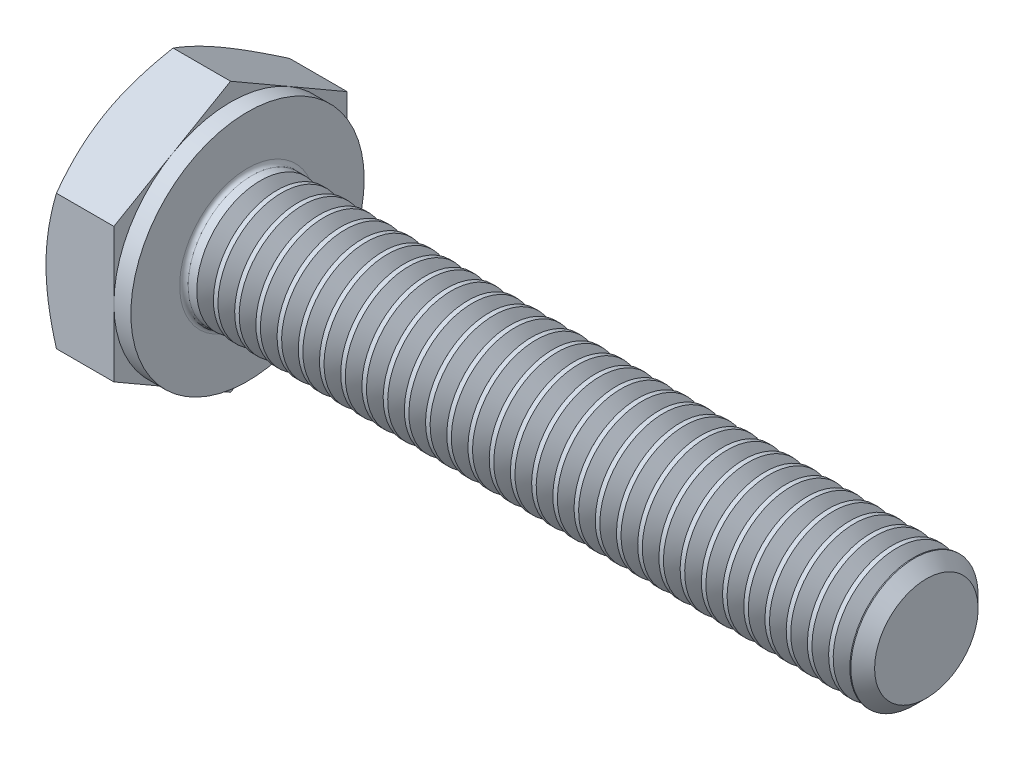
SolidWorks part; units mm, degrees
ref_plane "Plane1" through (0, 0, 0) normal (0, 0, 1) x (1, 0, 0)
ref_plane "Plane2" through (0, 0, 0) normal (0, 1, 0) x (1, 0, 0)
ref_plane "Plane3" through (0, 0, 0) normal (1, 0, 0) x (0, 0, -1)
sketch "Sketch1" plane through (0, 0, 0) normal (1, 0, 0) x (0, 0, -1)
  line L0 (2.75, 1.5877) -> (2.75, -1.5877)
  line L1 (-2.75, 1.5877) -> (-2.75, -1.5877)
  line L2 (2.75, -1.5877) -> (0, -3.1754)
  line L3 (0, -3.1754) -> (-2.75, -1.5877)
  line L4 (2.75, 1.5877) -> (0, 3.1754)
  line L5 (0, 3.1754) -> (-2.75, 1.5877)
  dimension "Width_flats" = 5.5
  dimension "D2" = 120
  dimension "D3" = 2.75
  dimension "D4" = 2.75
  dimension "D5" = 2.75
extrude "BaseHead" add sketch "Sketch1" along normal blind 2
sketch "BodySke" plane through (0, 0, 0) normal (0, 0, 1) x (1, 0, 0)
  line L0 (0, 1.5877) -> (0, -1.5877) construction
  line L1 (0, 0) -> (18, 0)
  line L2 (0, 0) -> (0, 1.5)
  line L3 (0, 1.5) -> (17.7195, 1.5)
  line L4 (18, 0) -> (18, 1.2195)
  line L5 (2, 3.1754) -> (2, 1.5877) construction
  line L6 (18, 1.2195) -> (17.7195, 1.5)
  line L7 (0, 0) -> (96.52, 0) construction
  line L8 (18, -1.2195) -> (17.7195, -1.5) construction
  line L9 (0, -1.5) -> (17.7195, -1.5) construction
  line L10 (2.5, 15.24) -> (2.5, -1.27) construction
  line L12 (2, 1.5877) -> (2, -1.5877) construction
  dimension "Length" = 16
  dimension "Body_ch_ang" = 45
  dimension "Diameter" = 3
  dimension "Minor_dia" = 2.439
  dimension "Advance" = 0.5
revolve "BaseBody" add sketch "BodySke"
fillet "HeadFillet" radius 0.1 1 edges at (2, 0, -1.5)
sketch "Sketch3" plane through (0, 0, 0) normal (0, 0, 1) x (1, 0, 0)
  line L0 (0, 2.75) -> (3.1324, 8.1754)
  line L1 (0, 3.1754) -> (0, 1.5877) construction
  line L2 (3.1324, 8.1754) -> (3.1324, 13.1754)
  line L3 (3.1324, 13.1754) -> (-10, 13.1754)
  line L4 (-10, 13.1754) -> (-10, 2.75)
  line L5 (-10, 2.75) -> (0, 2.75)
  line L6 (0, 0) -> (99.06, 0) construction
  line L7 (2, 3.1754) -> (0, 3.1754) construction
  dimension "D1" = 2.75
  dimension "D2" = 5
  dimension "D3" = 10
  dimension "D4" = 5
  dimension "Head_ch_ang" = 30
revolve "HeadChamfer" cut sketch "Sketch3" angle 360 about L6
sketch "Sketch4" plane through (0, 0, 0) normal (0, 0, 1) x (1, 0, 0)
  line L1 (2, 3.1754) -> (2, 1.5877) construction
  line L2 (2, 2.75) -> (1.6, 2.75)
  line L3 (2, 2.75) -> (2, 13.1754)
  line L4 (2, 13.1754) -> (1.6, 13.1754)
  line L5 (0, 0) -> (95.25, 0) construction
  line L6 (0, 0) -> (96.52, 0) construction
  line L7 (1.6, 2.75) -> (1.6, 13.1754)
  line L8 (2, 3.1754) -> (0.2456, 3.1754) construction
  dimension "D1" = 5.5
  dimension "D2" = 10
  dimension "Bearing_ht" = 0.4
revolve "BearingFace" cut sketch "Sketch4" angle 360 about L5
sketch "ThdSchSke" plane through (0, 0, 0) normal (0, 0, 1) x (1, 0, 0)
  line L0 (2.5, -1.2195) -> (2.3036, -1.5)
  line L1 (2.5, -1.2195) -> (2.6964, -1.5)
  line L2 (2.6964, -1.5) -> (2.6964, -1.875)
  line L3 (-3.175, 0) -> (5.1513, 0) construction
  line L5 (2.6964, -1.875) -> (2.3036, -1.875)
  line L6 (2.3036, -1.875) -> (2.3036, -1.5)
  dimension "Thread_minor" = 2.439
  dimension "Diameter" = 3
  dimension "Start" = 2.5
  dimension "SideAngle" = 55
  dimension "VeeAngle" = 70
  dimension "Overcut" = 3.75
revolve "ThreadSchematic" cut sketch "ThdSchSke" angle 360 about L3
pattern_linear "ThdSchPat" count 31 spacing 0.5 along (1, 0, 0) of "ThreadSchematic"
equation "\"D3@Sketch1\" = \"Width_flats@Sketch1\" / 2"
equation "\"D4@Sketch1\" = \"D3@Sketch1\""
equation "\"D5@Sketch1\" = \"D4@Sketch1\""
equation "\"Thread_minor@ThreadCosmetic\" = \"Minor_dia@BodySke\""
equation "\"D1@Sketch3\" = \"Width_flats@Sketch1\" / 2"
equation "\"D1@Sketch4\" = \"Width_flats@Sketch1\""
equation "\"Thread_length@ThreadCosmetic\" = \"Length@BodySke\" - \"Advance@BodySke\""
equation "\"Thread_minor@ThdSchSke\" = \"Minor_dia@BodySke\""
equation "\"Diameter@ThdSchSke\" = \"Diameter@BodySke\""
equation "\"Overcut@ThdSchSke\" = \"Diameter@BodySke\" * 1.25"
equation "\"Start@ThdSchSke\" = \"Head_ht@BaseHead\" + \"Length@BodySke\" - \"Thread_length@ThreadCosmetic\"  '---Non-countersunk---"
equation "\"Num_threads@ThdSchPat\" = int( \"Thread_length@ThreadCosmetic\" / \"Advance@BodySke\" + 0.999 )  + 1"
equation "\"Advance@ThdSchPat\" = \"Thread_length@ThreadCosmetic\" /  (\"Num_threads@ThdSchPat\" - 1) 'relax it"
equation "\"Num_threads@ThdSchPat\" = \"Num_threads@ThdSchPat\" - sgn( \"Num_threads@ThdSchPat\" - 1) '---chamfered tips only---"
